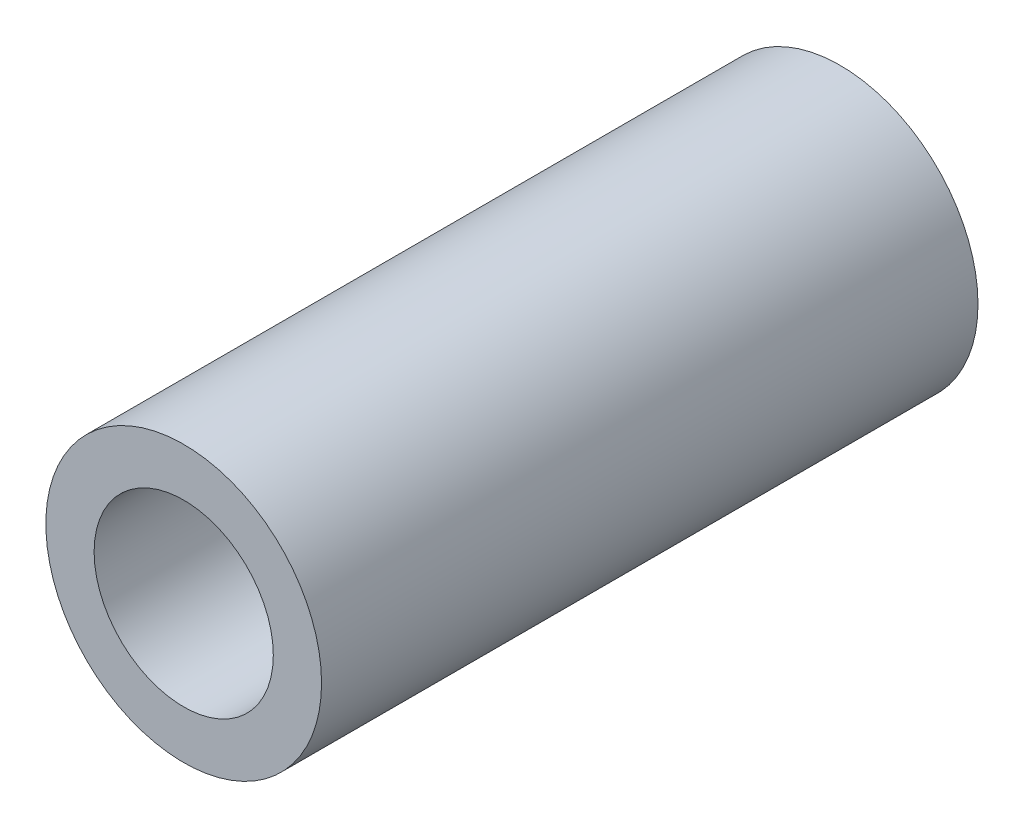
SolidWorks part; units mm, degrees
ref_plane "Front" through (0, 0, 0) normal (0, 0, 1) x (1, 0, 0)
ref_plane "Top" through (0, 0, 0) normal (0, 1, 0) x (1, 0, 0)
ref_plane "Side" through (0, 0, 0) normal (1, 0, 0) x (0, 0, -1)
sketch "PipeSketch"
  dimension "OuterDiameter" = 21.336
  dimension "InnerDiameter" = 13.8684
extrude "Extrusion" add sketch "PipeSketch" along normal blind 50.8
sketch "FilterSketch" plane through (0, 0, 0) normal (0, 0, 1) x (1, 0, 0)
  circle A0 centre (0, 0) radius 6.35 construction
  dimension "NominalDiameter" = 12.7
